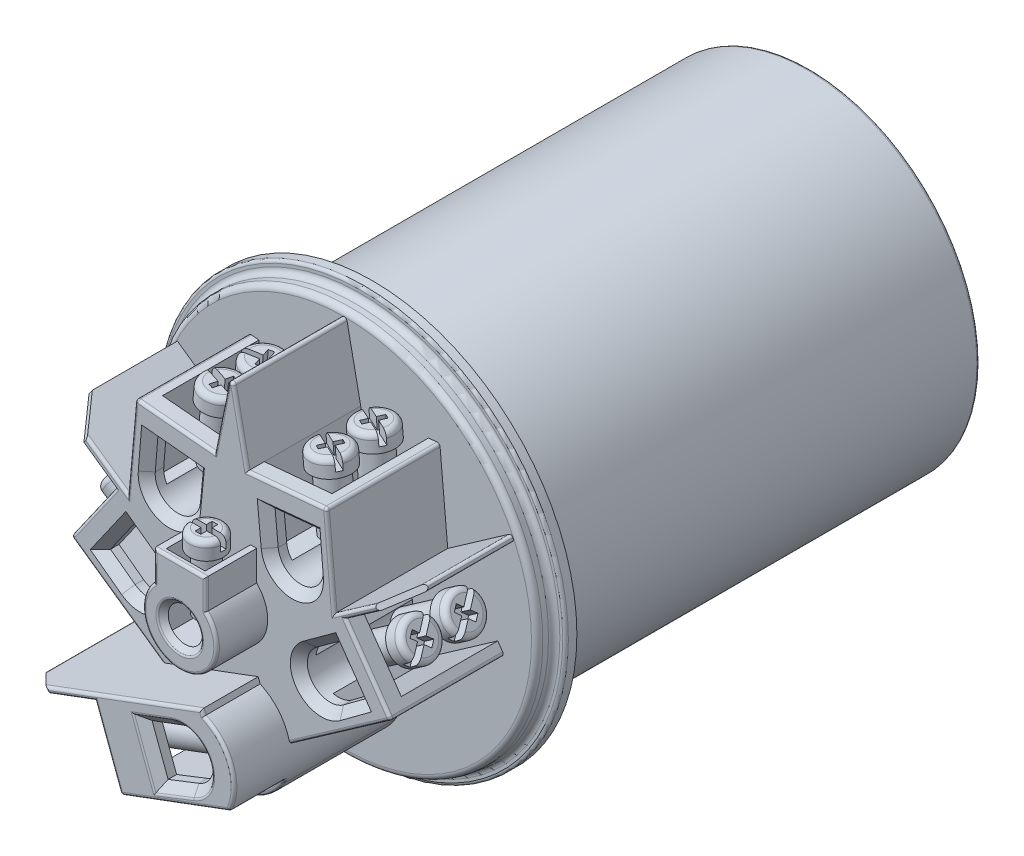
SolidWorks part; units mm, degrees
ref_plane "Спереди" through (0, 0, 0) normal (0, 0, 1) x (1, 0, 0)
ref_plane "Сверху" through (0, 0, 0) normal (0, 1, 0) x (1, 0, 0)
ref_plane "Справа" through (0, 0, 0) normal (1, 0, 0) x (0, 0, -1)
sketch "Эскиз1" plane through (0, 0, 0) normal (0, 0, 1) x (1, 0, 0)
  circle A0 centre (0, 0) radius 36
  dimension "D1" = 72
extrude "Бобышка-Вытянуть1" add sketch "Эскиз1" along normal blind 2
sketch "Эскиз2" plane through (0, 0, 2) normal (0, 0, 1) x (1, 0, 0)
  circle A0 centre (0, 0) radius 34
  dimension "D1" = 68
extrude "Бобышка-Вытянуть2" add sketch "Эскиз2" along normal blind 3
fillet "Скругление1" radius 1 2 edges at (34, 0, 5) (34, 0, 2)
fillet "Скругление2" radius 0.5 1 edges at (36, 0, 2)
sketch "Эскиз3" plane through (0, 0, 5) normal (0, 0, 1) x (1, 0, 0)
  line L1 (28.1952, -4.5923) -> (10.3998, -17.0527)
  line L4 (29.4157, 14.586) -> (29.9949, 13.7588)
  line L5 (29.9949, 13.7588) -> (20.1651, 6.8759)
  line L6 (20.1651, 6.8759) -> (28.1952, -4.5923)
  line L7 (-28.1952, -4.5923) -> (-12.1194, -15.8486)
  line L8 (-20.1651, 6.8759) -> (-28.1952, -4.5923)
  line L9 (-29.9949, 13.7588) -> (-20.1651, 6.8759)
  line L10 (-29.4157, 14.586) -> (-29.9949, 13.7588)
  line L20 (-9.4014, -29.7772) -> (-13.9457, -17.5974)
  line L21 (-13.9457, -17.5974) -> (-24.8814, -21.6775)
  line L22 (-24.8814, -21.6775) -> (-25.231, -20.7406)
  line L23 (-25.231, -20.7406) -> (-12.1194, -15.8486)
  line L24 (-4.5451, -27.9653) -> (-9.4014, -29.7772)
  line L25 (-22.7088, -4.594) -> (-18.1493, 1.9176)
  line L32 (13.6387, -1.357) -> (18.1493, 1.9176)
  line L33 (-18.3695, -7.8082) -> (-22.7088, -4.594)
  line L35 (-13.6387, -1.357) -> (-18.1493, 1.9176)
  line L37 (18.3695, -7.8082) -> (22.7088, -4.594)
  line L38 (22.7088, -4.594) -> (18.1493, 1.9176)
  line L39 (0.045, -15.0458) -> (-5.3834, -17.0711)
  line L40 (-5.3834, -17.0711) -> (-2.5568, -24.6471)
  line L41 (2.8967, -22.52) -> (-2.5568, -24.6471)
  line L50 (0, 35) -> (2.8967, 20.8355)
  line L55 (0, 35) -> (-2.8967, 20.8355)
  line L56 (2.8967, 20.8355) -> (16.8394, 22.1007)
  line L57 (16.8394, 22.1007) -> (18.2319, 6.755)
  line L58 (29.4157, 14.586) -> (18.2319, 6.755)
  line L59 (-16.8394, 22.1007) -> (-18.2319, 6.755)
  line L60 (-2.8967, 20.8355) -> (-16.8394, 22.1007)
  line L61 (-29.4157, 14.586) -> (-18.2319, 6.755)
  line L62 (14.8192, 11.1652) -> (14.3404, 16.9992)
  line L63 (6.8513, 10.4518) -> (6.292, 16.2186)
  line L64 (-6.292, 16.2186) -> (-14.3404, 16.9992)
  line L65 (-6.8513, 10.4518) -> (-6.292, 16.2186)
  line L66 (-14.8192, 11.1652) -> (-14.3404, 16.9992)
  line L67 (6.292, 16.2186) -> (14.3404, 16.9992)
  circle A0 centre (0, 0) radius 33 construction
  arc A3 (-4.5451, -27.9653) -> (9.009, -23.8933) centre (0, -18.5) ccw
  circle A9 centre (0, 0) radius 35 construction
  arc A12 (-14.8192, 11.1652) -> (-6.8513, 10.4518) centre (-10.8327, 10.8379) ccw
  arc A14 (2.8967, -22.52) -> (0.045, -15.0458) centre (1.4432, -18.7934) ccw
  arc A15 (9.009, -23.8933) -> (10.3998, -17.0527) centre (1.4432, -18.7934) ccw
  arc A16 (-18.3695, -7.8082) -> (-13.6387, -1.357) centre (-15.9886, -4.594) ccw
  arc A18 (18.3695, -7.8082) -> (13.6387, -1.357) centre (15.9886, -4.594) cw
  arc A19 (14.8192, 11.1652) -> (6.8513, 10.4518) centre (10.8327, 10.8379) cw
  point P27 (0, 0)
extrude "Бобышка-Вытянуть3" add sketch "Эскиз3" along normal blind 20
sketch "Эскиз4" plane through (0, 0, 25) normal (0, 0, 1) x (1, 0, 0)
  line L0 (-9.4014, -29.7772) -> (9.7145, -22.6451)
  line L1 (-13.9457, -17.5974) -> (5.1702, -10.4652)
  line L2 (-13.9457, -17.5974) -> (-9.4014, -29.7772)
  line L3 (-2.5568, -24.6471) -> (2.8967, -22.52)
  line L4 (0.045, -15.0458) -> (-5.3834, -17.0711)
  line L5 (-5.3834, -17.0711) -> (-2.5568, -24.6471)
  arc A0 (9.7145, -22.6451) -> (5.1702, -10.4652) centre (1.4432, -18.7934) ccw
  arc A1 (2.8967, -22.52) -> (0.045, -15.0458) centre (1.4432, -18.7934) ccw
extrude "Бобышка-Вытянуть4" add sketch "Эскиз4" along normal blind 11
ref_plane "Плоскость1" through (0, 0, 4) normal (0, 0, 1) x (1, 0, 0)
sketch "Эскиз5" plane through (0, 0, 4) normal (0, 0, 1) x (1, 0, 0)
  line L0 (-25.231, -20.7406) -> (-26.5539, -21.2342)
  line L1 (-13.9457, -17.5974) -> (-14.2953, -16.6605)
  line L2 (-13.9457, -17.5974) -> (-9.6182, -29.1962)
  line L3 (-13.9457, -17.5974) -> (-9.4014, -29.7772) construction
  line L4 (-9.6182, -29.1962) -> (-14.1845, -30.8999)
  line L5 (-12.1194, -15.8486) -> (-25.231, -20.7406) construction
  line L6 (-14.2953, -16.6605) -> (-25.231, -20.7406)
  arc A0 (-26.5539, -21.2342) -> (-14.1845, -30.8999) centre (0, 0) ccw
extrude "Бобышка-Вытянуть5" add sketch "Эскиз5" along normal blind 11
sketch "Эскиз6" plane through (0, 0, 15) normal (0, 0, 1) x (1, 0, 0)
  line L0 (-13.9457, -17.5974) -> (-25.8803, -22.0502)
  line L1 (-26.5539, -21.2342) -> (4.8207, -9.5283)
  line L2 (-25.5661, -20.8656) -> (-26.5539, -21.2342) construction
  line L3 (5.1702, -10.4652) -> (4.8207, -9.5283)
  line L4 (5.1702, -10.4652) -> (-13.9457, -17.5974)
  arc A0 (-26.5539, -21.2342) -> (-25.8803, -22.0502) centre (0, 0) ccw
extrude "Бобышка-Вытянуть6" add sketch "Эскиз6" along normal up to surface (21 mm away)
chamfer "Фаска1" distance 5 angle 45 3 edges at (29.7053, 14.1724, 25) (-29.7053, 14.1724, 25) (-26.2203, -21.6448, 36)
other "Переместить грань1" parameters "D1"=1
sketch "Эскиз7" plane through (-18.0049, -6.7177, 0) normal (-0.9369, -0.3496, 0) x (0, 0, 1)
  line L2 (32, -18.1123) -> (32, -11.6123)
  line L3 (35, -11.6123) -> (15, -11.6123) construction
  line L4 (32, -18.1123) -> (32, -23.6123)
  line L5 (32, -23.6123) -> (15, -23.6123)
  line L6 (15, -23.9921) -> (15, -11.6123) construction
  line L7 (15, -23.6123) -> (15, -11.6123)
  line L8 (15, -11.6123) -> (32, -11.6123)
extrude "Вырез-Вытянуть2" cut sketch "Эскиз7" against normal blind 16
sketch "Эскиз8" plane through (16.7616, 11.7366, 0) normal (0.8192, 0.5736, 0) x (0, 0, -1)
  line L2 (-22, -12.9338) -> (-22, -5.9338)
  line L3 (-22, -5.9338) -> (-5, -5.9338)
  line L4 (-5, -19.9338) -> (-5, -5.9338) construction
  line L5 (-5, -5.9338) -> (-5, -17.9338)
  line L6 (-5, -17.9338) -> (-22, -17.9338)
  line L7 (-22, -17.9338) -> (-22, -12.9338)
extrude "Вырез-Вытянуть3" cut sketch "Эскиз8" against normal blind 13
sketch "Эскиз9" plane through (-16.7616, 11.7366, 0) normal (-0.8192, 0.5736, 0) x (0, 0, 1)
  line L2 (22, -12.9338) -> (22, -5.9338)
  line L3 (25, -5.9338) -> (5, -5.9338) construction
  line L4 (22, -5.9338) -> (5, -5.9338)
  line L5 (5, -5.9338) -> (5, -17.9338)
  line L6 (5, -5.9338) -> (5, -19.9338) construction
  line L7 (5, -17.9338) -> (22, -17.9338)
  line L8 (22, -17.9338) -> (22, -12.9338)
extrude "Вырез-Вытянуть4" cut sketch "Эскиз9" against normal blind 13
sketch "Эскиз17" plane through (-16.7616, 11.7366, 0) normal (-0.8192, 0.5736, 0) x (0, 0, 1)
  circle A0 centre (18.0348, -12.5753) radius 2.5
  circle A1 centre (10.6448, -12.5753) radius 2.5
  dimension "D1" = 5
  dimension "D2" = 5
extrude "Бобышка-Вытянуть8" add sketch "Эскиз17" against normal blind 12 separate body
sketch "Эскиз18" plane through (-16.7616, 11.7366, 0) normal (-0.8192, 0.5736, 0) x (0, 0, 1)
  circle A0 centre (18.0348, -12.5753) radius 3.5
  circle A1 centre (10.6448, -12.5753) radius 3.5
extrude "Бобышка-Вытянуть9" add sketch "Эскиз18" along normal blind 3
fillet "Скругление4" radius 1 1 edges at (-28.4395, 0.2892, 18.0348)
fillet "Скругление5" radius 1 1 edges at (-28.4395, 0.2892, 10.6448)
sketch "Эскиз19" plane through (-19.219, 13.4573, 0) normal (-0.8192, 0.5736, 0) x (0, 0, 1)
  line L0 (18.8216, -8.1717) -> (17.7073, -11.848)
  line L1 (16.3194, -16.4273) -> (17.5705, -16.8065)
  line L2 (17.5705, -16.8065) -> (18.6613, -13.2075)
  line L3 (20.0726, -8.5509) -> (18.8216, -8.1717)
  line L4 (19.4471, -13.4456) -> (18.6613, -13.2075)
  line L5 (16.5156, -12.5571) -> (16.8127, -11.5768)
  line L6 (19.4471, -13.4456) -> (19.7442, -12.4653)
  line L7 (19.7442, -12.4653) -> (18.9584, -12.2272)
  line L8 (17.7073, -11.848) -> (16.8127, -11.5768)
  line L9 (17.4102, -12.8283) -> (16.5156, -12.5571)
  line L10 (18.9584, -12.2272) -> (20.0726, -8.5509)
  line L11 (17.4102, -12.8283) -> (16.3194, -16.4273)
  line L12 (10.102, -16.8065) -> (11.1928, -13.2075)
  line L13 (12.6042, -8.5509) -> (11.3531, -8.1717)
  line L14 (9.9418, -12.8283) -> (8.8509, -16.4273)
  line L15 (9.9418, -12.8283) -> (9.0471, -12.5571)
  line L16 (11.9786, -13.4456) -> (11.1928, -13.2075)
  line L17 (8.8509, -16.4273) -> (10.102, -16.8065)
  line L18 (10.2389, -11.848) -> (9.3442, -11.5768)
  line L19 (12.2758, -12.4653) -> (11.49, -12.2272)
  line L20 (11.9786, -13.4456) -> (12.2758, -12.4653)
  line L21 (11.49, -12.2272) -> (12.6042, -8.5509)
  line L22 (11.3531, -8.1717) -> (10.2389, -11.848)
  line L23 (9.0471, -12.5571) -> (9.3442, -11.5768)
extrude "Вырез-Вытянуть9" cut sketch "Эскиз19" against normal blind 2
sketch "Эскиз20" plane through (-18.0049, -6.7177, 0) normal (-0.9369, -0.3496, 0) x (0, 0, 1)
  circle A0 centre (27.6047, -18.183) radius 2.5
  circle A1 centre (19.6908, -18.183) radius 2.5
  dimension "D1" = 5
  dimension "D2" = 5
extrude "Бобышка-Вытянуть10" add sketch "Эскиз20" against normal blind 15 separate body
sketch "Эскиз21" plane through (-18.0049, -6.7177, 0) normal (-0.9369, -0.3496, 0) x (0, 0, 1)
  circle A0 centre (27.6047, -18.183) radius 3.5
  circle A1 centre (19.6908, -18.183) radius 3.5
extrude "Бобышка-Вытянуть11" add sketch "Эскиз21" along normal blind 3
fillet "Скругление6" radius 1 1 edges at (-13.2361, -28.0814, 27.6047)
fillet "Скругление7" radius 1 1 edges at (-13.2361, -28.0814, 19.6908)
sketch "Эскиз22" plane through (-20.8157, -7.7663, 0) normal (-0.9369, -0.3496, 0) x (0, 0, 1)
  line L0 (28.4192, -14.2839) -> (28.2212, -17.608)
  line L1 (27.9537, -22.0978) -> (26.8735, -22.0334)
  line L2 (26.8735, -22.0334) -> (27.0827, -18.5216)
  line L3 (27.339, -14.2196) -> (28.4192, -14.2839)
  line L4 (28.1629, -18.5859) -> (27.9537, -22.0978)
  line L5 (28.1629, -18.5859) -> (29.473, -18.664)
  line L6 (29.473, -18.664) -> (29.5313, -17.686)
  line L7 (29.5313, -17.686) -> (28.2212, -17.608)
  line L8 (25.8485, -17.4666) -> (25.7902, -18.4446)
  line L9 (25.7902, -18.4446) -> (27.0827, -18.5216)
  line L10 (27.141, -17.5436) -> (25.8485, -17.4666)
  line L11 (27.141, -17.5436) -> (27.339, -14.2196)
  line L12 (21.457, -18.8064) -> (21.5152, -17.8285)
  line L13 (19.1249, -17.686) -> (17.8325, -17.609)
  line L14 (19.9377, -22.2402) -> (18.8575, -22.1758)
  line L15 (17.8325, -17.609) -> (17.7742, -18.587)
  line L16 (21.5152, -17.8285) -> (20.2052, -17.7504)
  line L17 (19.1249, -17.686) -> (19.323, -14.362)
  line L18 (20.1469, -18.7283) -> (19.9377, -22.2402)
  line L19 (18.8575, -22.1758) -> (19.0667, -18.664)
  line L20 (17.7742, -18.587) -> (19.0667, -18.664)
  line L21 (20.4032, -14.4263) -> (20.2052, -17.7504)
  line L22 (19.323, -14.362) -> (20.4032, -14.4263)
  line L23 (20.1469, -18.7283) -> (21.457, -18.8064)
extrude "Вырез-Вытянуть10" cut sketch "Эскиз22" against normal blind 2
sketch "Эскиз29" plane through (16.7616, 11.7366, 0) normal (0.8192, 0.5736, 0) x (0, 0, -1)
  circle A0 centre (-17.5137, -12.3093) radius 2.5
  circle A1 centre (-9.6715, -12.3093) radius 2.5
  dimension "D1" = 5
  dimension "D2" = 5
extrude "Бобышка-Вытянуть16" add sketch "Эскиз29" against normal blind 10 separate body
sketch "Эскиз30" plane through (16.7616, 11.7366, 0) normal (0.8192, 0.5736, 0) x (0, 0, -1)
  circle A0 centre (-17.5137, -12.3093) radius 3.5
  circle A1 centre (-9.6715, -12.3093) radius 3.5
  dimension "D1" = 7
  dimension "D2" = 7
extrude "Бобышка-Вытянуть17" add sketch "Эскиз30" along normal blind 3
fillet "Скругление12" radius 1 1 edges at (24.2718, 6.2412, 17.5137)
fillet "Скругление13" radius 1 1 edges at (24.2718, 6.2412, 9.6715)
sketch "Эскиз31" plane through (19.219, 13.4573, 0) normal (0.8192, 0.5736, 0) x (0, 0, -1)
  line L0 (-12.9269, -14.6827) -> (-10.6048, -12.3606)
  line L1 (-7.2012, -8.957) -> (-6.4701, -9.6881)
  line L2 (-6.4701, -9.6881) -> (-9.0429, -12.2608)
  line L3 (-12.1959, -15.4138) -> (-12.9269, -14.6827)
  line L4 (-9.8737, -13.0916) -> (-9.0105, -13.9549)
  line L5 (-9.774, -11.5298) -> (-10.6106, -10.6931)
  line L6 (-10.6106, -10.6931) -> (-11.4414, -11.524)
  line L7 (-11.4414, -11.524) -> (-10.6048, -12.3606)
  line L8 (-9.0105, -13.9549) -> (-8.1797, -13.1241)
  line L9 (-8.1797, -13.1241) -> (-9.0429, -12.2608)
  line L10 (-9.8737, -13.0916) -> (-12.1959, -15.4138)
  line L11 (-9.774, -11.5298) -> (-7.2012, -8.957)
  line L12 (-20.0127, -15.4622) -> (-20.7437, -14.7312)
  line L13 (-18.4274, -10.7416) -> (-19.2582, -11.5724)
  line L14 (-17.6905, -13.1401) -> (-16.8273, -14.0033)
  line L15 (-20.7437, -14.7312) -> (-18.4216, -12.409)
  line L16 (-15.9965, -13.1725) -> (-16.8597, -12.3093)
  line L17 (-19.2582, -11.5724) -> (-18.4216, -12.409)
  line L18 (-17.5908, -11.5782) -> (-18.4274, -10.7416)
  line L19 (-17.6905, -13.1401) -> (-20.0127, -15.4622)
  line L20 (-15.018, -9.0054) -> (-14.2869, -9.7365)
  line L21 (-14.2869, -9.7365) -> (-16.8597, -12.3093)
  line L22 (-17.5908, -11.5782) -> (-15.018, -9.0054)
  line L23 (-16.8273, -14.0033) -> (-15.9965, -13.1725)
extrude "Вырез-Вытянуть13" cut sketch "Эскиз31" against normal blind 2
sketch "Эскиз32" plane through (0, 0, 5) normal (0, 0, 1) x (1, 0, 0)
  circle A0 centre (0, 0) radius 30
  dimension "D1" = 60
extrude "Бобышка-Вытянуть18" add sketch "Эскиз32" against normal blind 82
sketch "Эскиз33" plane through (0, 0, -77) normal (0, 0, -1) x (-1, 0, 0)
  circle A1 centre (-1.0623, -18.4695) radius 4.5
  point P16 (0, 0)
extrude "Вырез-Вытянуть15" cut sketch "Эскиз33" against normal blind 70
sketch "Эскиз34" plane through (0, 0, -77) normal (0, 0, -1) x (-1, 0, 0)
  circle A0 centre (-1.0623, -18.4695) radius 5.5
  dimension "D1" = 11
extrude "Вырез-Вытянуть16" cut sketch "Эскиз34" against normal blind 70
chamfer "Фаска4" distance 1.5 angle 45 1 edges at (-4.4377, -18.4695, -77)
sketch "Эскиз36" plane through (0, 0, -77) normal (0, 0, -1) x (-1, 0, 0)
  circle A0 centre (0, 0) radius 3.5
extrude "Вырез-Вытянуть18" cut sketch "Эскиз36" against normal blind 70
chamfer "Фаска5" distance 1.5 angle 45 1 edges at (-3.5, 0, -77)
sketch "Эскиз44" plane through (0, 0, 25) normal (0, 0, 1) x (1, 0, 0)
  line L0 (-4.5545, 4.6375) -> (-4.5545, 9.9351)
  line L2 (4.5545, 4.6375) -> (4.5545, 9.9351)
  line L3 (-4.5545, 9.9351) -> (4.5545, 9.9351)
  arc A0 (-4.5545, 4.6375) -> (4.5545, 4.6375) centre (0, 0) ccw
  dimension "D1" = 13
extrude "Бобышка-Вытянуть23" add sketch "Эскиз44" along normal blind 9
sketch "Эскиз45" plane through (0, 9.9351, 0) normal (0, 1, 0) x (0, 0, 1)
  line L0 (25, 3.4792) -> (33.0181, 3.4792)
  line L1 (25, 4.5545) -> (25, -4.5545) construction
  line L2 (33.0181, 3.4792) -> (33.0181, -3.3648)
  line L3 (33.0181, -3.3648) -> (25, -3.3648)
  line L4 (25, -3.3648) -> (25, 3.4792)
extrude "Вырез-Вытянуть22" cut sketch "Эскиз45" against normal blind 13
sketch "Эскиз46" plane through (0, 0, 34) normal (0, 0, 1) x (1, 0, 0)
  circle A0 centre (0, 0) radius 2.5
  dimension "D1" = 5
extrude "Вырез-Вытянуть23" cut sketch "Эскиз46" against normal blind 24
sketch "Эскиз52" plane through (-1.8515, 20.4047, 0) normal (-0.0904, 0.9959, 0) x (0.9959, 0.0904, 0)
  line L5 (16.7677, -5) -> (4.7677, -5)
  line L6 (4.7677, -5) -> (4.7677, -22)
  line L7 (4.7677, -25) -> (4.7677, -5) construction
  line L8 (4.7677, -22) -> (16.7677, -22)
  line L9 (16.7677, -22) -> (16.7677, -5)
extrude "Вырез-Вытянуть27" cut sketch "Эскиз52" against normal blind 13
sketch "Эскиз53" plane through (1.8515, 20.4047, 0) normal (0.0904, 0.9959, 0) x (0.9959, -0.0904, 0)
  line L2 (-16.9642, -22) -> (-4.7677, -22)
  line L3 (-4.7677, -25) -> (-4.7677, -5) construction
  line L4 (-4.7677, -22) -> (-4.7677, -5)
  line L5 (-4.7677, -5) -> (-16.9642, -5)
  line L6 (-4.7677, -5) -> (-18.7677, -5) construction
  line L7 (-16.9642, -5) -> (-16.9642, -22)
extrude "Вырез-Вытянуть28" cut sketch "Эскиз53" against normal blind 13
sketch "Эскиз54" plane through (1.8515, 20.4047, 0) normal (0.0904, 0.9959, 0) x (0.9959, -0.0904, 0)
  circle A0 centre (-11.5343, -17.0813) radius 2.5
  circle A1 centre (-11.5343, -9.6893) radius 2.5
  dimension "D1" = 5
  dimension "D2" = 5
extrude "Бобышка-Вытянуть24" add sketch "Эскиз54" against normal blind 10 separate body
sketch "Эскиз55" plane through (1.8515, 20.4047, 0) normal (0.0904, 0.9959, 0) x (0.9959, -0.0904, 0)
  circle A0 centre (-11.5343, -17.0813) radius 3.5
  circle A1 centre (-11.5343, -9.6893) radius 3.5
  dimension "D1" = 7
  dimension "D2" = 7
extrude "Бобышка-Вытянуть25" add sketch "Эскиз55" along normal blind 3
fillet "Скругление22" radius 1 1 edges at (-12.8502, 24.751, 17.0813)
fillet "Скругление23" radius 1 1 edges at (-12.8502, 24.751, 9.6893)
sketch "Эскиз56" plane through (-1.8515, 20.4047, 0) normal (-0.0904, 0.9959, 0) x (0.9959, 0.0904, 0)
  circle A0 centre (11.8267, -17.1391) radius 2.5
  circle A1 centre (11.8267, -9.4487) radius 2.5
  dimension "D1" = 5
  dimension "D2" = 5
extrude "Бобышка-Вытянуть26" add sketch "Эскиз56" against normal blind 10 separate body
sketch "Эскиз57" plane through (-1.8515, 20.4047, 0) normal (-0.0904, 0.9959, 0) x (0.9959, 0.0904, 0)
  circle A0 centre (11.8267, -17.1391) radius 3.5
  circle A1 centre (11.8267, -9.4487) radius 3.5
  dimension "D1" = 7
  dimension "D2" = 7
extrude "Бобышка-Вытянуть27" add sketch "Эскиз57" along normal blind 3
fillet "Скругление24" radius 1 1 edges at (6.1701, 24.1449, 17.1391)
fillet "Скругление25" radius 1 1 edges at (6.1701, 24.1449, 9.4487)
sketch "Эскиз58" plane through (0, 9.9351, 0) normal (0, 1, 0) x (1, 0, 0)
  circle A0 centre (0, -29.2878) radius 2
  dimension "D1" = 4
extrude "Бобышка-Вытянуть28" add sketch "Эскиз58" against normal blind 10 separate body
sketch "Эскиз59" plane through (0, 9.9351, 0) normal (0, 1, 0) x (1, 0, 0)
  circle A0 centre (0, -29.2878) radius 3
  dimension "D1" = 6
extrude "Бобышка-Вытянуть29" add sketch "Эскиз59" along normal blind 3
fillet "Скругление26" radius 1 1 edges at (-3, 12.9351, 29.2878)
sketch "Эскиз60" plane through (2.1226, 23.3924, 0) normal (0.0904, 0.9959, 0) x (0.9959, -0.0904, 0)
  line L0 (-15.4456, -16.5298) -> (-11.989, -17.434)
  line L1 (-7.8402, -18.5193) -> (-7.5799, -17.5245)
  line L2 (-7.5799, -17.5245) -> (-10.9408, -16.6454)
  line L3 (-15.1853, -15.535) -> (-15.4456, -16.5298)
  line L4 (-7.5799, -9.1218) -> (-10.8673, -10.0643)
  line L5 (-15.1853, -11.3023) -> (-15.436, -10.428)
  line L6 (-15.436, -10.428) -> (-12.0136, -9.4468)
  line L7 (-7.71, -8.213) -> (-7.5799, -9.1218)
  line L8 (-10.9408, -16.6454) -> (-10.627, -15.4456)
  line L9 (-11.989, -17.434) -> (-12.3223, -18.7082)
  line L10 (-12.3223, -18.7082) -> (-11.5343, -18.9143)
  line L11 (-11.5343, -18.9143) -> (-11.201, -17.6401)
  line L12 (-10.627, -15.4456) -> (-11.4149, -15.2395)
  line L13 (-11.7287, -16.4392) -> (-11.4149, -15.2395)
  line L14 (-11.201, -17.6401) -> (-7.8402, -18.5193)
  line L15 (-11.7287, -16.4392) -> (-15.1853, -15.535)
  line L16 (-11.118, -9.19) -> (-7.71, -8.213)
  line L17 (-11.7629, -10.3211) -> (-11.4191, -11.5204)
  line L18 (-11.4191, -11.5204) -> (-10.5235, -11.2636)
  line L19 (-10.5235, -11.2636) -> (-10.8673, -10.0643)
  line L20 (-11.4806, -7.9252) -> (-12.3673, -8.213)
  line L21 (-12.3673, -8.213) -> (-12.0136, -9.4468)
  line L22 (-11.7629, -10.3211) -> (-15.1853, -11.3023)
  line L23 (-11.118, -9.19) -> (-11.4806, -7.9252)
extrude "Вырез-Вытянуть29" cut sketch "Эскиз60" against normal blind 2
sketch "Эскиз61" plane through (-2.1226, 23.3924, 0) normal (-0.0904, 0.9959, 0) x (0.9959, 0.0904, 0)
  line L0 (14.9885, -19.3675) -> (12.0165, -17.8217)
  line L1 (8.0901, -15.7794) -> (8.5567, -14.8822)
  line L2 (8.5567, -14.8822) -> (11.6929, -16.5134)
  line L3 (15.4552, -18.4703) -> (14.9885, -19.3675)
  line L4 (15.1614, -11.7943) -> (12.0451, -10.2217)
  line L5 (8.0901, -8.2259) -> (8.56, -7.2946)
  line L6 (8.56, -7.2946) -> (11.6686, -8.8633)
  line L7 (15.6314, -10.863) -> (15.1614, -11.7943)
  line L8 (12.4832, -16.9245) -> (13.0788, -15.7794)
  line L9 (11.2263, -17.4106) -> (10.6751, -18.4703)
  line L10 (10.6751, -18.4703) -> (11.4653, -18.8814)
  line L11 (11.4653, -18.8814) -> (12.0165, -17.8217)
  line L12 (13.0788, -15.7794) -> (12.2885, -15.3684)
  line L13 (12.2885, -15.3684) -> (11.6929, -16.5134)
  line L14 (11.2263, -17.4106) -> (8.0901, -15.7794)
  line L15 (12.4832, -16.9245) -> (15.4552, -18.4703)
  line L17 (11.1987, -9.7946) -> (10.6751, -10.8322)
  line L18 (10.6751, -10.8322) -> (11.5215, -11.2593)
  line L19 (11.5215, -11.2593) -> (12.0451, -10.2217)
  line L20 (13.0788, -8.1733) -> (12.2324, -7.7462)
  line L21 (12.2324, -7.7462) -> (11.6686, -8.8633)
  line L22 (11.1987, -9.7946) -> (8.0901, -8.2259)
  line L23 (12.5151, -9.2904) -> (13.0788, -8.1733)
  line L24 (12.5151, -9.2904) -> (15.6314, -10.863)
extrude "Вырез-Вытянуть30" cut sketch "Эскиз61" against normal blind 2
sketch "Эскиз62" plane through (0, 12.9351, 0) normal (0, 1, 0) x (1, 0, 0)
  line L0 (-0.4991, -29.7483) -> (-3.2405, -29.7483)
  line L1 (3.2405, -28.8273) -> (0.4991, -28.8273)
  line L2 (3.2405, -28.8273) -> (3.2405, -29.7483)
  line L3 (3.2405, -29.7483) -> (0.4991, -29.7483)
  line L4 (-3.2405, -28.8273) -> (-3.2405, -29.7483)
  line L6 (-0.4991, -28.8273) -> (-3.2405, -28.8273)
  line L7 (0.4991, -27.7893) -> (-0.4991, -27.7893)
  line L8 (0.4991, -27.7893) -> (0.4991, -28.8273)
  line L9 (0.4991, -30.7863) -> (-0.4991, -30.7863)
  line L10 (-0.4991, -27.7893) -> (-0.4991, -28.8273)
  line L12 (-0.4991, -29.7483) -> (-0.4991, -30.7863)
  line L14 (0.4991, -29.7483) -> (0.4991, -30.7863)
  point P0 (0, -29.2878)
  point P6 (0, -29.2878)
extrude "Вырез-Вытянуть31" cut sketch "Эскиз62" against normal blind 2
chamfer "Фаска6" distance 1.5 angle 45 21 edges at (-10.3162, 16.6089, 25) (-14.5798, 14.0822, 25) (-11.1893, 6.8539, 25) (-6.5717, 13.3352, 25) (10.3162, 16.6089, 25) (6.5717, 13.3352, 25) (11.1893, 6.8539, 25) (14.5798, 14.0822, 25) (20.4291, -1.3382, 25) (15.894, 0.2803, 25) (12.763, -6.9594, 25) (20.5392, -6.2011, 25) (-20.4291, -1.3382, 25) (-20.5392, -6.2011, 25) (-12.763, -6.9594, 25) (-15.894, 0.2803, 25) (0.17, -23.5835, 35) (5.1804, -17.3675, 35) (-2.6692, -16.0584, 35) (-3.9701, -20.8591, 35) (2.5, 0, 34)
fillet "Скругление27" radius 0.5 44 edges at (9.7145, -22.6451, 30) (3.0211, -28.556, 25) (2.5847, -25.3052, 25) (9.3863, -23.2831, 25) (4.9954, -9.9967, 35) (9.9917, -15.604, 35) (0.1566, -26.2112, 35) (-11.6736, -23.6873, 35) (-17.9014, -19.0732, 35) (-22.2223, -20.1536, 35) (-8.8799, -14.64, 35) (-3.8962, -14.9152, 35) (-5.3715, -21.3939, 35) (0.0059, -25.2576, 35) (6.5819, -16.8328, 35) (4.5545, 7.2863, 34) (0, -6.5, 34) (-4.5545, 7.2863, 34) (0, 9.9351, 34) (4, 0, 34) (29.9949, 13.7588, 12.5) (28.1952, -4.5923, 15) (29.4157, 14.586, 12.5) (16.8394, 22.1007, 15) (-16.8394, 22.1007, 15) (-28.1952, -4.5923, 15) (-26.5539, -21.2342, 17.5) (-14.1845, -30.8999, 9.5) (-11.9013, -30.048, 15) (-20.5153, -27.1132, 15) (-4.5451, -27.9653, 15) (9.8681, 21.4681, 25) (17.5357, 14.4278, 25) (21.7759, 9.2365, 25) (23.0321, 8.8834, 25) (24.1801, 1.1418, 25) (19.2975, -10.8225, 25) (-24.1801, 1.1418, 25) (-20.1573, -10.2204, 25) (-21.7759, 9.2365, 25) (-17.5357, 14.4278, 25) (-9.8681, 21.4681, 25) (1.4484, 27.9178, 25) (-1.4484, 27.9178, 25)
fillet "Скругление28" radius 0.5 4 edges at (0, 34.2691, 24.8536) (0, 35, 14.75) (-9.3154, -29.5888, 34.8536) (-9.4014, -29.7772, 19.75)
sketch "Эскиз63" plane through (0, 0, -77) normal (0, 0, -1) x (-1, 0, 0)
  circle A0 centre (-1.0623, -18.4695) radius 4.5
  circle A1 centre (-17.8938, -4.6971) radius 4.5
  circle A2 centre (-9.9967, 15.5665) radius 4.5
  circle A3 centre (11.7155, 14.3177) radius 4.5
  circle A4 centre (17.2372, -6.7177) radius 4.5
  point P14 (0, 0)
  dimension "D1" = 9
  dimension "D2" = 5
extrude "Вырез-Вытянуть32" cut sketch "Эскиз63" against normal blind 70
sketch "Эскиз64" plane through (0, 0, -77) normal (0, 0, -1) x (-1, 0, 0)
  circle A0 centre (-17.8938, -4.6971) radius 8.5
  circle A1 centre (-9.9967, 15.5665) radius 8.5
  circle A2 centre (11.7155, 14.3177) radius 8.5
  circle A3 centre (17.2372, -6.7177) radius 8.5
  dimension "D1" = 17
extrude "Вырез-Вытянуть33" cut sketch "Эскиз64" against normal blind 11
fillet "Скругление29" radius 0.5 5 edges at (30, 0, -77) (-25.7372, -6.7177, -77) (-20.2155, 14.3177, -77) (1.4967, 15.5665, -77) (9.3938, -4.6971, -77)
